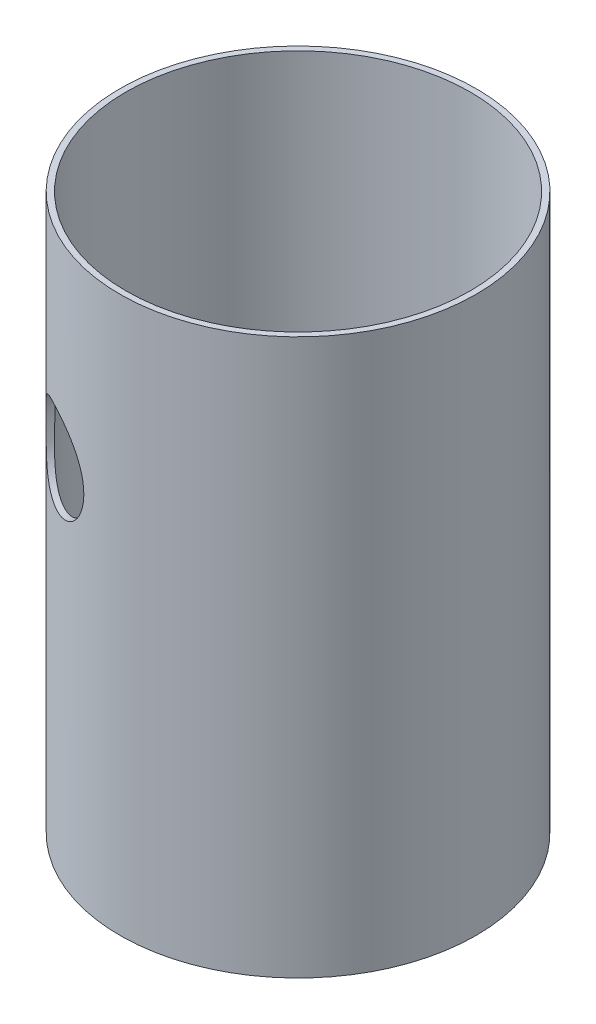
SolidWorks part; units mm, degrees
ref_plane "Ebene vorne" through (0, 0, 0) normal (0, 0, 1) x (1, 0, 0)
ref_plane "Ebene oben" through (0, 0, 0) normal (0, 1, 0) x (1, 0, 0)
ref_plane "Ebene rechts" through (0, 0, 0) normal (1, 0, 0) x (0, 0, -1)
sketch "Skizze3" plane through (0, 0, 0) normal (0, 1, 0) x (1, 0, 0)
  line L0 (0, 0) -> (0, 330.8614) construction
  line L1 (0, 330.8614) -> (306.6684, 330.8614) construction
  circle A0 centre (100.5734, 330.8614) radius 204.7036
extrude "Linear-Austragen-Dünn1" add sketch "Skizze3" along normal blind 233 and the other way blind 427 thin
sketch "Skizze1" plane through (0, 0, 0) normal (0, 0, 1) x (1, 0, 0)
  line L0 (0, 0) -> (0, 55.4607) construction
  circle A0 centre (0, 0) radius 50
  circle A1 centre (0, 0) radius 52
  dimension "D1" = 100
  dimension "D2" = 2
extrude "Schnitt-Linear austragen1" cut sketch "Skizze1" against normal up to surface (132.0042 mm away) contours A1
equation "\"LÄNGE\"=0"
equation "\"BREITE\"=0"
equation "\"HÖHE\"=0"
equation "\"DURCHMESSER\"=0"
equation "\"Stückzahl\"= 1"
